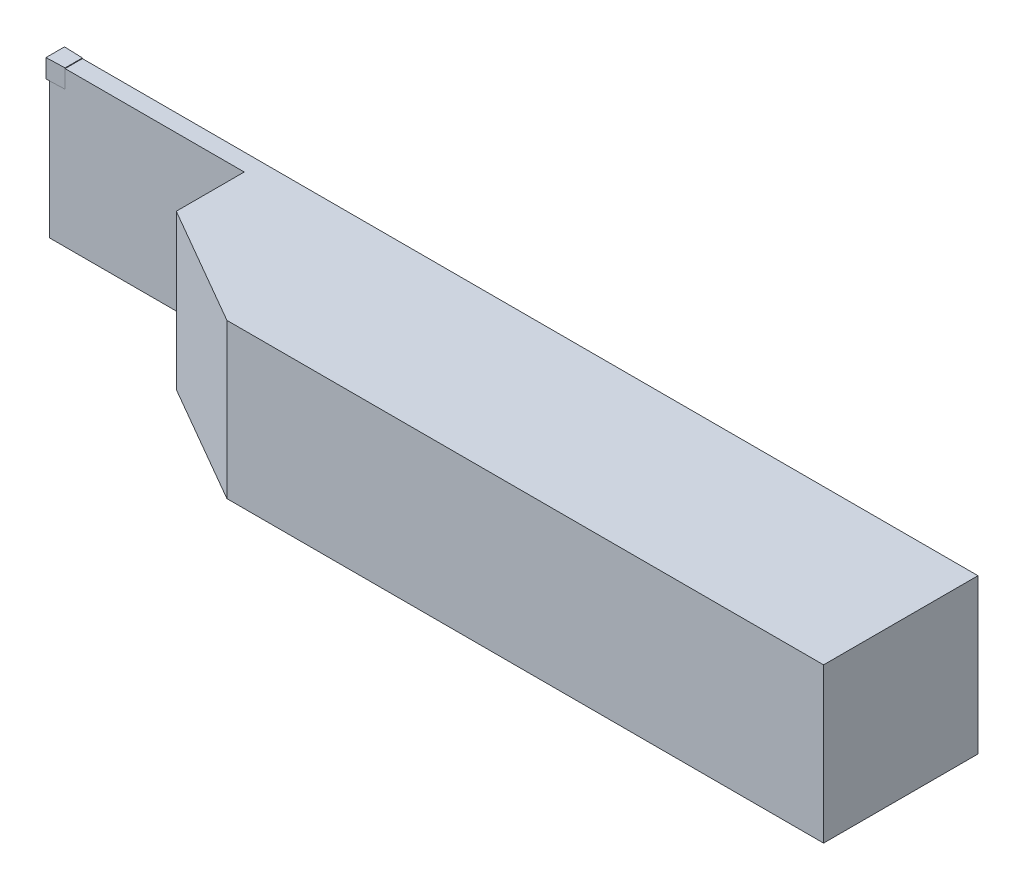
SolidWorks part; units mm, degrees
ref_plane "Plan1" through (0, 0, 0) normal (0, 0, 1) x (1, 0, 0)
ref_plane "Plan2" through (0, 0, 0) normal (0, 1, 0) x (1, 0, 0)
ref_plane "Plan3" through (0, 0, 0) normal (1, 0, 0) x (0, 0, -1)
sketch "EsqPlaquette" plane through (0, 0, 0) normal (0, 1, 0) x (1, 0, 0)
  line L0 (0, -0.0103) -> (0, -2.9897)
  line L1 (0.0103, -0.0003) -> (2.9903, -0.0997)
  line L2 (3, -0.1097) -> (3, -2.8903)
  line L3 (2.9903, -2.9003) -> (0.0103, -2.9997)
  arc A0 (0.0103, -0.0003) -> (0, -0.0103) centre (0.01, -0.0103) ccw
  arc A1 (0.0103, -2.9997) -> (0, -2.9897) centre (0.01, -2.9897) cw
  arc A2 (3, -2.8903) -> (2.9903, -2.9003) centre (2.99, -2.8903) cw
  arc A3 (2.9903, -0.0997) -> (3, -0.1097) centre (2.99, -0.1097) cw
  point P7 (0, 0)
  point P10 (0, -3)
  point P13 (3, -2.9)
  point P16 (3, -0.1)
  dimension "RBec" = 0.01
  dimension "D2" = 3
  dimension "D3" = 0.1
  dimension "D4" = 2.8
  dimension "la" = 3
extrude "Plaquette" add sketch "EsqPlaquette" against normal blind 3
ref_plane "Plan4" through (0, -0.1, 0) normal (0, 1, 0) x (-1, 0, 0)
sketch "EsqCorps" plane through (0, -0.1, 0) normal (0, 1, 0) x (-1, 0, 0)
  line L0 (-0.5, 0.1) -> (-148, 0.1)
  line L2 (-0.5, 2.9) -> (-32, 2.9)
  line L3 (-32, 2.9) -> (-32, 13.9)
  line L4 (-32, 13.9) -> (-51.399, 25.1)
  line L5 (-51.399, 25.1) -> (-148, 25.1)
  line L6 (-148, 25.1) -> (-148, 0.1)
  line L7 (-0.5, 0.1) -> (-0.5, 2.9)
  dimension "D1" = 25
  dimension "D2" = 0.5
  dimension "D3" = 2.8
  dimension "D4" = 0.1
  dimension "D5" = 11
  dimension "D6" = 60
  dimension "D7" = 32
  dimension "D8" = 116
extrude "CorpsOutil" add sketch "EsqCorps" against normal blind 25
